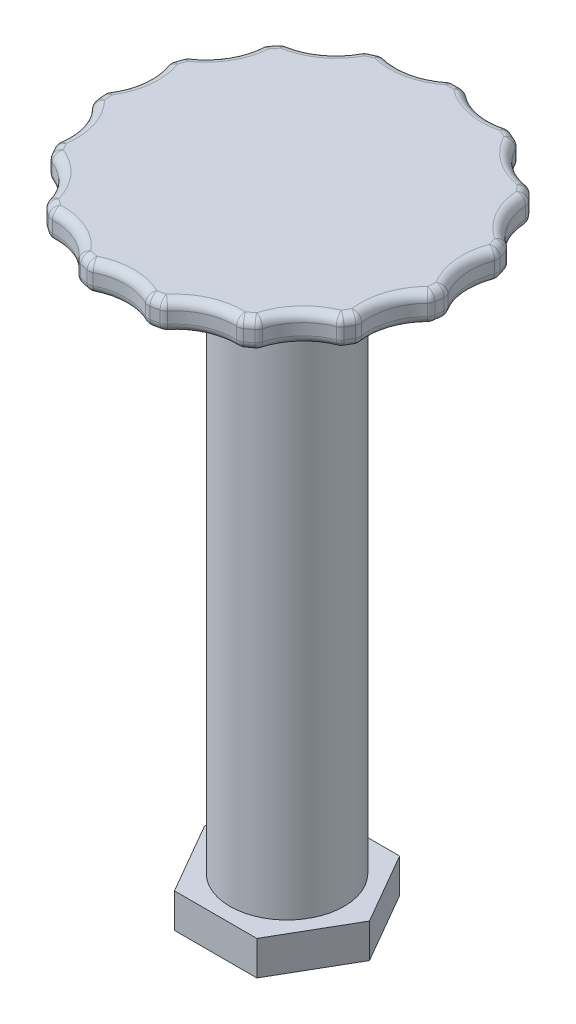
SolidWorks part; units mm, degrees
other "Shaft"
other "Knob"
ref_plane "Front Plane" through (0, 0, 0) normal (0, 0, 1) x (1, 0, 0)
ref_plane "Top Plane" through (0, 0, 0) normal (0, 1, 0) x (1, 0, 0)
ref_plane "Right Plane" through (0, 0, 0) normal (1, 0, 0) x (0, 0, -1)
sketch "Sketch1" plane through (0, 0, 0) normal (0, 1, 0) x (1, 0, 0)
  line L1 (9.1654, -15.875) -> (18.3309, 0)
  line L2 (18.3309, 0) -> (9.1654, 15.875)
  line L3 (9.1654, 15.875) -> (-9.1654, 15.875)
  line L4 (-9.1654, 15.875) -> (-18.3309, 0)
  line L5 (-18.3309, 0) -> (-9.1654, -15.875)
  line L6 (-9.1654, -15.875) -> (9.1654, -15.875)
  circle A0 centre (0, 0) radius 15.875 construction
  dimension "D1" = 31.75
extrude "Key" add sketch "Sketch1" along normal blind 7.62
sketch "Sketch2" plane through (0, 7.62, 0) normal (0, 1, 0) x (1, 0, 0)
  circle A0 centre (0, 0) radius 12.7
  dimension "D1" = 25.4
extrude "Shaft and Weight Holder" add sketch "Sketch2" along normal blind 127 separate body
sketch "Sketch4" plane through (0, 134.62, 0) normal (0, 1, 0) x (1, 0, 0)
  line L0 (0, -49.1485) -> (0, -35.9405) construction
  line L1 (0, -35.9405) -> (0, 0) construction
  circle A0 centre (0, 0) radius 38.1
  arc A1 (-6.35, -37.5671) -> (6.35, -37.5671) centre (0, -49.1485) cw
  arc A2 (-21.0809, -31.7365) -> (-9.4789, -36.902) centre (-19.9905, -44.8994) cw
  arc A3 (-32.1668, -20.4183) -> (-23.6688, -29.8563) centre (-36.5245, -32.8868) cw
  arc A4 (-37.6907, -5.5697) -> (-33.7662, -17.6481) centre (-46.743, -15.1877) cw
  arc A5 (-36.6976, 10.242) -> (-38.0251, -2.3884) centre (-48.8793, 5.1374) cw
  arc A6 (-29.3591, 24.2828) -> (-35.7091, 13.2843) centre (-42.5639, 24.5743) cw
  arc A7 (-16.9441, 34.1249) -> (-27.2186, 26.66) centre (-28.8888, 39.762) cw
  arc A8 (-1.5994, 38.0664) -> (-14.0219, 35.4259) centre (-10.2185, 48.0745) cw
  arc A9 (14.0219, 35.4259) -> (1.5994, 38.0664) centre (10.2185, 48.0745) cw
  arc A10 (27.2186, 26.66) -> (16.9441, 34.1249) centre (28.8888, 39.762) cw
  arc A11 (35.7091, 13.2843) -> (29.3591, 24.2828) centre (42.5639, 24.5743) cw
  arc A12 (38.0251, -2.3884) -> (36.6976, 10.242) centre (48.8793, 5.1374) cw
  arc A13 (33.7662, -17.6481) -> (37.6907, -5.5697) centre (46.743, -15.1877) cw
  arc A14 (23.6688, -29.8563) -> (32.1668, -20.4183) centre (36.5245, -32.8868) cw
  arc A15 (9.4789, -36.902) -> (21.0809, -31.7365) centre (19.9905, -44.8994) cw
  point P19 (0, 0)
  dimension "D1" = 76.2
  dimension "D2" = 12.7
  dimension "D3" = 13.208
  dimension "D4" = 15
extrude "Knob" add sketch "Sketch4" along normal blind 6.35 separate body
fillet "Fillet1" radius 1.905 30 edges at (-27.2186, 137.795, -26.66) (-16.9441, 137.795, -34.1249) (-14.0219, 137.795, -35.4259) (-1.5994, 137.795, -38.0664) (1.5994, 137.795, -38.0664) (14.0219, 137.795, -35.4259) (16.9441, 137.795, -34.1249) (27.2186, 137.795, -26.66) (29.3591, 137.795, -24.2828) (35.7091, 137.795, -13.2843) (36.6976, 137.795, -10.242) (38.0251, 137.795, 2.3884) (37.6907, 137.795, 5.5697) (33.7662, 137.795, 17.6481) (32.1668, 137.795, 20.4183) (23.6688, 137.795, 29.8563) (21.0809, 137.795, 31.7365) (9.4789, 137.795, 36.902) (6.35, 137.795, 37.5671) (-6.35, 137.795, 37.5671) (-9.4789, 137.795, 36.902) (-21.0809, 137.795, 31.7365) (-23.6688, 137.795, 29.8563) (-32.1668, 137.795, 20.4183) (-33.7662, 137.795, 17.6481) (-37.6907, 137.795, 5.5697) (-38.0251, 137.795, 2.3884) (-36.6976, 137.795, -10.242) (-35.7091, 137.795, -13.2843) (-29.3591, 137.795, -24.2828)
fillet "Fillet2" radius 1.905 120 edges at (27.1957, 134.62, -26.5516) (28.3138, 134.62, -25.4939) (29.2489, 134.62, -24.2713) (31.1254, 134.62, -17.9703) (35.644, 134.62, -13.1946) (36.2353, 134.62, -11.7735) (36.5922, 134.62, -10.2764) (35.7436, 134.62, -3.7568) (37.9292, 134.62, 2.4439) (37.8913, 134.62, 3.9825) (37.6084, 134.62, 5.4955) (34.1815, 134.62, 11.1062) (33.656, 134.62, 17.6598) (32.9956, 134.62, 19.05) (32.1218, 134.62, 20.3171) (26.709, 134.62, 24.0489) (23.5634, 134.62, 29.8221) (22.3946, 134.62, 30.8235) (21.081, 134.62, 31.6257) (14.6183, 134.62, 32.8333) (9.3965, 134.62, 36.828) (7.9214, 134.62, 37.2674) (6.3952, 134.62, 37.4659) (0, 134.62, 35.9405) (-6.3952, 134.62, 37.4659) (-7.9214, 134.62, 37.2674) (-9.3965, 134.62, 36.828) (-14.6183, 134.62, 32.8333) (-21.081, 134.62, 31.6257) (-22.3946, 134.62, 30.8235) (-23.5634, 134.62, 29.8221) (-26.709, 134.62, 24.0489) (-32.1218, 134.62, 20.3171) (-32.9956, 134.62, 19.05) (-33.656, 134.62, 17.6598) (-34.1815, 134.62, 11.1062) (-37.6084, 134.62, 5.4955) (-37.8913, 134.62, 3.9825) (-37.9292, 134.62, 2.4439) (-35.7436, 134.62, -3.7568) (-36.5922, 134.62, -10.2764) (-36.2353, 134.62, -11.7735) (-35.644, 134.62, -13.1946) (-31.1254, 134.62, -17.9703) (-29.2489, 134.62, -24.2713) (-28.3138, 134.62, -25.4939) (-27.1957, 134.62, -26.5516) (-21.1253, 134.62, -29.0765) (-16.8481, 134.62, -34.0696) (-15.4967, 134.62, -34.8061) (-14.045, 134.62, -35.3176) (-7.4725, 134.62, -35.1551) (-1.5342, 134.62, -37.9769) (0, 134.62, -38.1) (1.5342, 134.62, -37.9769) (7.4725, 134.62, -35.1551) (14.045, 134.62, -35.3176) (15.4967, 134.62, -34.8061) (16.8481, 134.62, -34.0696) (27.1957, 140.97, -26.5516) (28.3138, 140.97, -25.4939) (29.2489, 140.97, -24.2713) (31.1254, 140.97, -17.9703) (35.644, 140.97, -13.1946) (36.2353, 140.97, -11.7735) (36.5922, 140.97, -10.2764) (35.7436, 140.97, -3.7568) (37.9292, 140.97, 2.4439) (37.8913, 140.97, 3.9825) (37.6084, 140.97, 5.4955) (34.1815, 140.97, 11.1062) (33.656, 140.97, 17.6598) (32.9956, 140.97, 19.05) (32.1218, 140.97, 20.3171) (26.709, 140.97, 24.0489) (23.5634, 140.97, 29.8221) (22.3946, 140.97, 30.8235) (21.081, 140.97, 31.6257) (14.6183, 140.97, 32.8333) (9.3965, 140.97, 36.828) (7.9214, 140.97, 37.2674) (6.3952, 140.97, 37.4659) (0, 140.97, 35.9405) (-6.3952, 140.97, 37.4659) (-7.9214, 140.97, 37.2674) (-9.3965, 140.97, 36.828) (-14.6183, 140.97, 32.8333) (-21.081, 140.97, 31.6257) (-22.3946, 140.97, 30.8235) (-23.5634, 140.97, 29.8221) (-26.709, 140.97, 24.0489) (-32.1218, 140.97, 20.3171) (-32.9956, 140.97, 19.05) (-33.656, 140.97, 17.6598) (-34.1815, 140.97, 11.1062) (-37.6084, 140.97, 5.4955) (-37.8913, 140.97, 3.9825) (-37.9292, 140.97, 2.4439) (-35.7436, 140.97, -3.7568) (-36.5922, 140.97, -10.2764) (-36.2353, 140.97, -11.7735) (-35.644, 140.97, -13.1946) (-31.1254, 140.97, -17.9703) (-29.2489, 140.97, -24.2713) (-28.3138, 140.97, -25.4939) (-27.1957, 140.97, -26.5516) (-21.1253, 140.97, -29.0765) (-16.8481, 140.97, -34.0696) (-15.4967, 140.97, -34.8061) (-14.045, 140.97, -35.3176) (-7.4725, 140.97, -35.1551) (-1.5342, 140.97, -37.9769) (0, 140.97, -38.1) (1.5342, 140.97, -37.9769) (7.4725, 140.97, -35.1551) (14.045, 140.97, -35.3176) (15.4967, 140.97, -34.8061) (16.8481, 140.97, -34.0696) (21.1253, 134.62, -29.0765) (21.1253, 140.97, -29.0765)
sketch "Sketch5" plane through (0, 134.62, 0) normal (0, -1, 0) x (1, 0, 0)
  line L1 (-5.715, 5.715) -> (5.715, 5.715)
  line L2 (-5.715, 5.715) -> (-5.715, -5.715)
  line L3 (-5.715, -5.715) -> (5.715, -5.715)
  line L4 (5.715, 5.715) -> (5.715, -5.715)
  line L5 (-5.715, 5.715) -> (5.715, -5.715) construction
  line L6 (-5.715, -5.715) -> (5.715, 5.715) construction
  point P0 (0, 0)
  dimension "D1" = 11.43
extrude "Boss-Extrude1" add sketch "Sketch5" along normal blind 15.24
chamfer "Chamfer1" distance 2.2225 angle 45 4 edges at (0, 134.62, 5.715) (-5.715, 134.62, 0) (0, 134.62, -5.715) (5.715, 134.62, 0)
fillet "Fillet3" radius 1.27 4 edges at (0, 119.38, -5.715) (-5.715, 119.38, 0) (0, 119.38, 5.715) (5.715, 119.38, 0)
sketch "Sketch6" plane through (0, 119.38, 0) normal (0, -1, 0) x (1, 0, 0)
  line L0 (0, 4.445) -> (0, -4.445) construction
  line L1 (4.445, 4.445) -> (-4.445, 4.445) construction
  line L2 (-4.445, -4.445) -> (4.445, -4.445) construction
  circle A0 centre (0, 0) radius 4.445 construction
  point P6 (0, 0)
